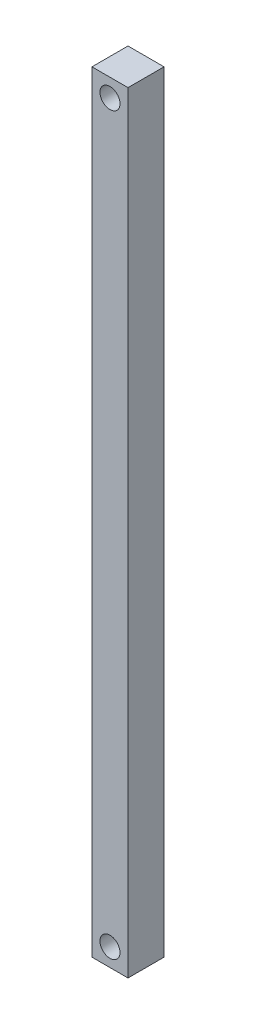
SolidWorks part; units mm, degrees
ref_plane "Front Plane" through (0, 0, 0) normal (0, 0, 1) x (1, 0, 0)
ref_plane "Top Plane" through (0, 0, 0) normal (0, 1, 0) x (1, 0, 0)
ref_plane "Right Plane" through (0, 0, 0) normal (1, 0, 0) x (0, 0, -1)
sketch "Sketch1" plane through (0, 0, 0) normal (0, 0, 1) x (1, 0, 0)
  line L0 (55, 0) -> (-55, 0) construction
  line L1 (-3.7697, 0) -> (14.9303, 0)
  line L2 (-3.7697, 0) -> (-3.7697, 400)
  line L3 (-3.7697, 400) -> (14.9303, 400)
  line L4 (14.9303, 0) -> (14.9303, 400)
  line L5 (5.5803, 400) -> (5.5803, 0) construction
  circle A0 centre (5.5803, 390.65) radius 5.2
  circle A1 centre (5.5803, 9.35) radius 5.2
  dimension "D3" = 10.4
  dimension "D1" = 18.7
  dimension "D2" = 400
  dimension "D4" = 9.35
  dimension "D6" = 9.35
extrude "Boss-Extrude1" add sketch "Sketch1" along normal blind 18.7
